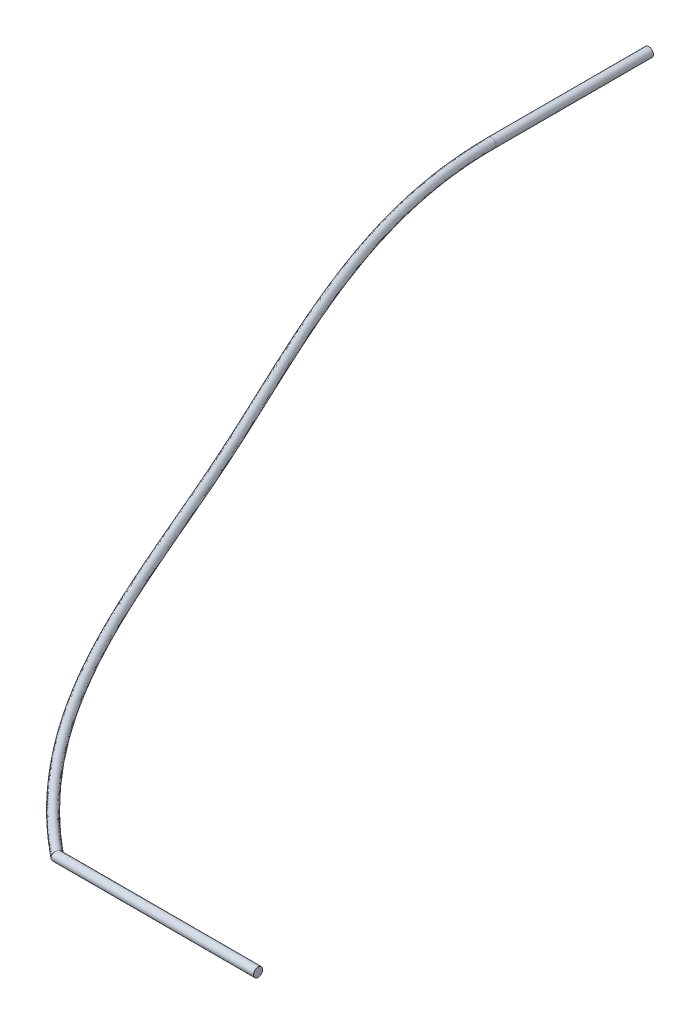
SolidWorks part; units mm, degrees
ref_plane "前视基准面" through (0, 0, 0) normal (0, 0, 1) x (1, 0, 0)
ref_plane "上视基准面" through (0, 0, 0) normal (0, 1, 0) x (1, 0, 0)
ref_plane "右视基准面" through (0, 0, 0) normal (1, 0, 0) x (0, 0, -1)
sketch "草图1" plane through (0, 0, 0) normal (0, 1, 0) x (1, 0, 0)
  line L0 (0, 0) -> (0, -13.7802)
  line L1 (35.0986, -86.9387) -> (52.7032, -86.9387)
  spline S0 degree 3 poles (0, -13.7802) (0, -25.3951) (14.8717, -51.836) (22.6585, -76.804) (35.0986, -86.9387) knots 0 0 0 0 0.45795 1 1 1 1
sketch "草图2" plane through (0, 0, 0) normal (0, 0, 1) x (1, 0, 0)
  circle A0 centre (0, 0) radius 0.4
  dimension "D1" = 0.8
sweep "扫描1" add profiles "草图2" path "草图1"
